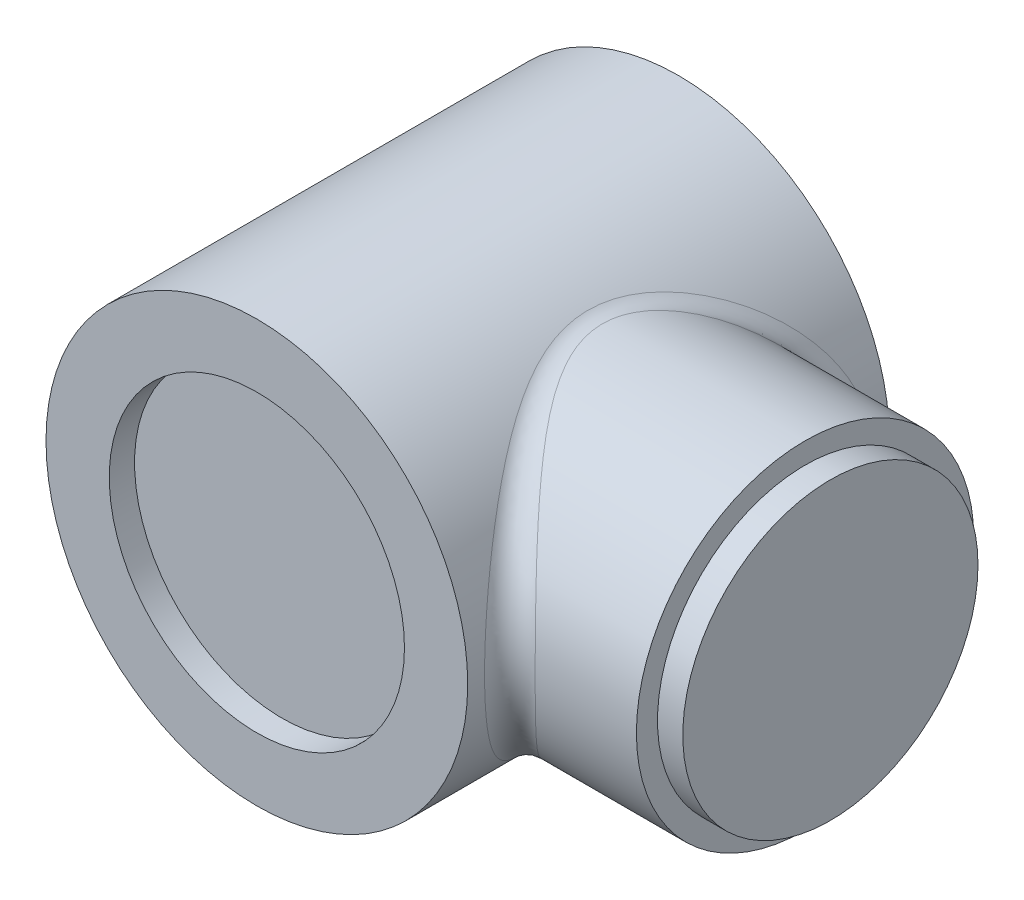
SolidWorks part; units mm, degrees
ref_plane "Front Plane" through (0, 0, 0) normal (0, 0, 1) x (1, 0, 0)
ref_plane "Top Plane" through (0, 0, 0) normal (0, 1, 0) x (1, 0, 0)
ref_plane "Right Plane" through (0, 0, 0) normal (1, 0, 0) x (0, 0, -1)
sketch "Sketch1" plane through (0, 0, 0) normal (0, 0, 1) x (1, 0, 0)
  circle A0 centre (0, 0) radius 25
  dimension "D1" = 50
extrude "Boss-Extrude1" add sketch "Sketch1" along normal mid plane 50
sketch "Sketch2" plane through (0, 0, 25) normal (0, 0, 1) x (1, 0, 0)
  circle A0 centre (0, 0) radius 17.5
  dimension "D1" = 35
extrude "Cut-Extrude1" cut sketch "Sketch2" against normal blind 3
mirror "Mirror1" about plane through (0, 0, 0) normal (0, 0, 1) of "Cut-Extrude1"
sketch "Sketch5" plane through (0, 0, 0) normal (1, 0, 0) x (0, 0, -1)
  circle A0 centre (0, 0) radius 20
  dimension "D1" = 40
extrude "Boss-Extrude2" add sketch "Sketch5" along normal blind 40
sketch "Sketch6" plane through (40, 0, 0) normal (1, 0, 0) x (0, 0, -1)
  circle A0 centre (0, 0) radius 17.5
  dimension "D1" = 35
extrude "Boss-Extrude3" add sketch "Sketch6" along normal blind 3
fillet "Fillet1" radius 3 1 edges at (24.89, 2.3429, -19.8623)
